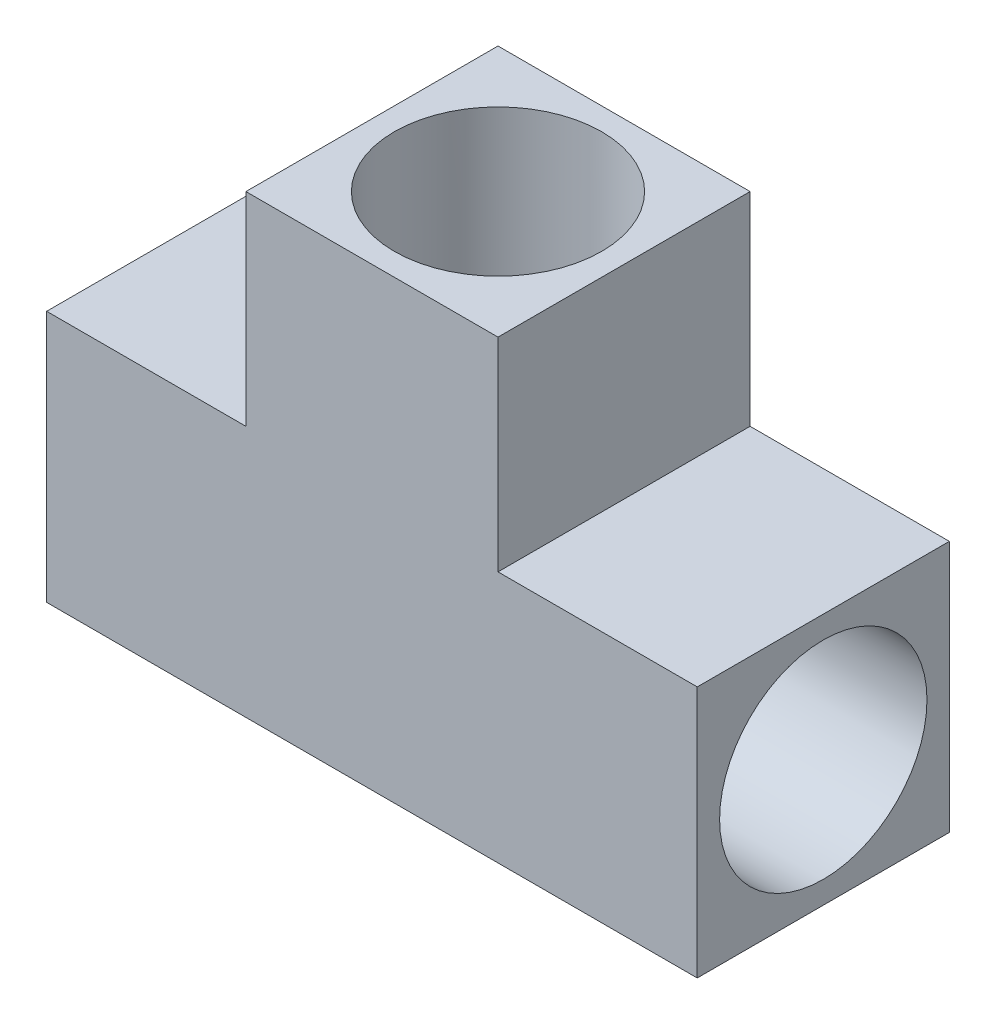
SolidWorks part; units mm, degrees
ref_plane "Front Plane" through (0, 0, 0) normal (0, 0, 1) x (1, 0, 0)
ref_plane "Top Plane" through (0, 0, 0) normal (0, 1, 0) x (1, 0, 0)
ref_plane "Right Plane" through (0, 0, 0) normal (1, 0, 0) x (0, 0, -1)
sketch "Sketch1" plane through (0, 0, 0) normal (0, 0, 1) x (1, 0, 0)
  line L0 (-10.16, 0) -> (-10.16, 7.874)
  line L1 (-10.16, 7.874) -> (-3.937, 7.874)
  line L2 (-10.16, 0) -> (10.16, 0)
  line L3 (10.16, 0) -> (10.16, 7.874)
  line L4 (10.16, 7.874) -> (3.937, 7.874)
  line L5 (-3.937, 7.874) -> (-3.937, 14.224)
  line L6 (-3.937, 14.224) -> (3.937, 14.224)
  line L7 (3.937, 14.224) -> (3.937, 7.874)
extrude "Extrude1" add sketch "Sketch1" along normal blind 7.874
sketch "Sketch2" plane through (-10.16, 0, 0) normal (-1, 0, 0) x (0, 0, 1)
  circle A0 centre (3.937, 3.937) radius 3.2385
extrude "Cut-Extrude1" cut sketch "Sketch2" against normal through all
sketch "Sketch4" plane through (0, 14.224, 0) normal (0, 1, 0) x (-1, 0, 0)
  circle A0 centre (0, 3.937) radius 3.2385
extrude "Cut-Extrude2" cut sketch "Sketch4" against normal blind 13.5255
